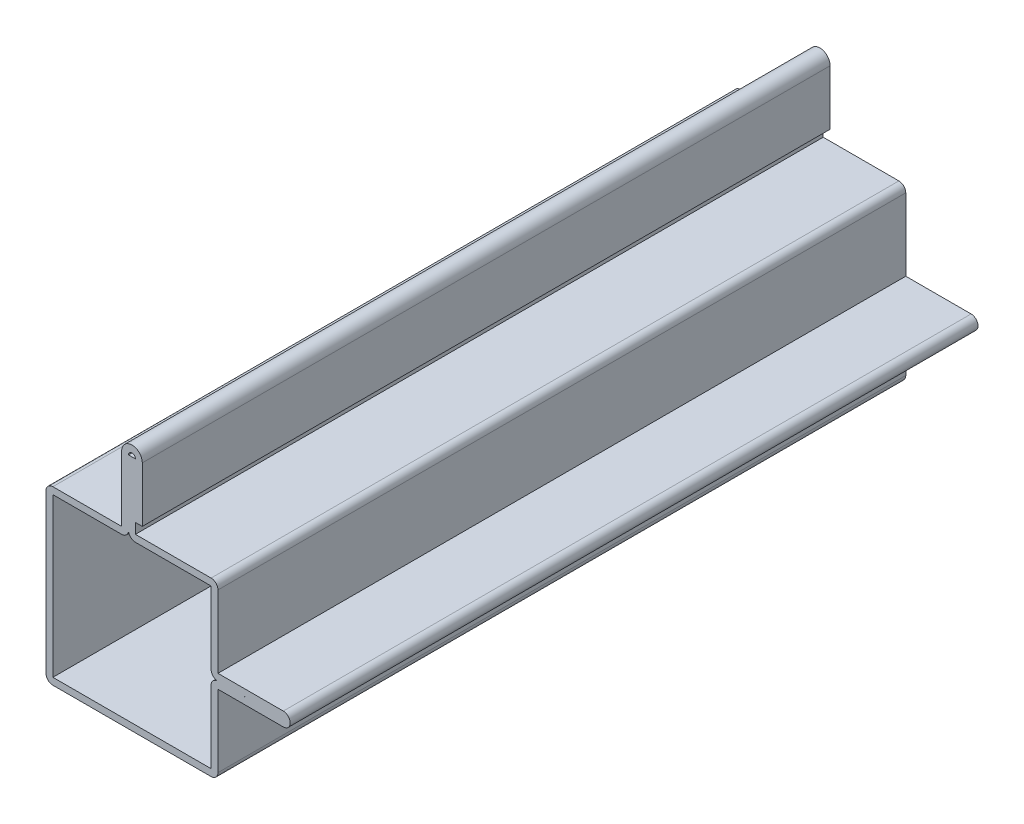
SolidWorks part; units mm, degrees
ref_plane "Ebene vorne" through (0, 0, 0) normal (0, 0, 1) x (1, 0, 0)
ref_plane "Ebene oben" through (0, 0, 0) normal (0, 1, 0) x (1, 0, 0)
ref_plane "Ebene rechts" through (0, 0, 0) normal (1, 0, 0) x (0, 0, -1)
sketch "Skizze1" plane through (0, 0, 0) normal (0, 0, 1) x (1, 0, 0)
  line L0 (24, 48) -> (24, 68) construction
  line L1 (0, 0) -> (48, 0) construction
  line L2 (0, 0) -> (0, 48) construction
  line L3 (0, 48) -> (21.9999, 48) construction
  line L4 (48, 0) -> (48, 22.9995) construction
  line L5 (21.9999, 48) -> (21.9999, 68) construction
  line L6 (26.0001, 68) -> (26.0001, 52) construction
  line L7 (48, 22.9995) -> (68, 22.9995) construction
  line L8 (68, 25.0005) -> (48, 25.0005) construction
  line L9 (48, 25.0005) -> (48, 48) construction
  line L10 (24, 48) -> (48, 48) construction
  line L12 (27.0001, 68) -> (27.0001, 52)
  line L13 (20.9999, 49) -> (20.9999, 68)
  line L14 (-1, 49) -> (20.9999, 49)
  line L15 (-1, -1) -> (-1, 49)
  line L16 (-1, -1) -> (49, -1)
  line L17 (49, -1) -> (49, 21.9995)
  line L18 (49, 21.9995) -> (68, 21.9995)
  line L19 (68, 26.0005) -> (49, 26.0005)
  line L20 (49, 26.0005) -> (49, 49)
  line L21 (25, 49) -> (49, 49)
  line L22 (25, 49) -> (25, 68)
  line L23 (25.0001, 68) -> (25.0001, 52)
  line L24 (22.9999, 47) -> (22.9999, 68)
  line L25 (1, 47) -> (22.9999, 47)
  line L26 (1, 1) -> (1, 47)
  line L27 (1, 1) -> (47, 1)
  line L28 (47, 1) -> (47, 23.9995)
  line L29 (47, 23.9995) -> (68, 23.9995)
  line L30 (68, 24.0005) -> (47, 24.0005)
  line L31 (47, 24.0005) -> (47, 47)
  line L32 (23, 47) -> (47, 47)
  line L33 (23, 47) -> (23, 68)
  line L34 (27.0001, 52) -> (25.0001, 52)
  line L35 (25, 68) -> (23, 68)
  arc A0 (21.9999, 68) -> (26.0001, 68) centre (24, 68) cw construction
  arc A1 (68, 22.9995) -> (68, 25.0005) centre (68, 24) ccw construction
  arc A2 (20.9999, 68) -> (27.0001, 68) centre (24, 68) cw
  arc A3 (68, 21.9995) -> (68, 26.0005) centre (68, 24) ccw
  arc A4 (22.9999, 68) -> (25.0001, 68) centre (24, 68) cw
  arc A5 (68, 23.9995) -> (68, 24.0005) centre (68, 24) ccw
  dimension "D1" = 48
  dimension "D2" = 48
  dimension "D3" = 20
  dimension "D4" = 4
  dimension "D5" = 2.0001
  dimension "D6" = 2.001
  dimension "D7" = 20
  dimension "D8" = 24
  dimension "D9" = 24
  dimension "D10" = 1
  dimension "D11" = 1
extrude "Linear austragen1" add sketch "Skizze1" along normal blind 200
fillet "Verrundung1" radius 2 6 edges at (22.9999, 47, 100) (47, 23.9995, 100) (49, 49, 100) (49, -1, 100) (-1, -1, 100) (-1, 49, 100)
fillet "Verrundung2" radius 2 2 edges at (47, 24.0005, 100) (23, 47, 100)
